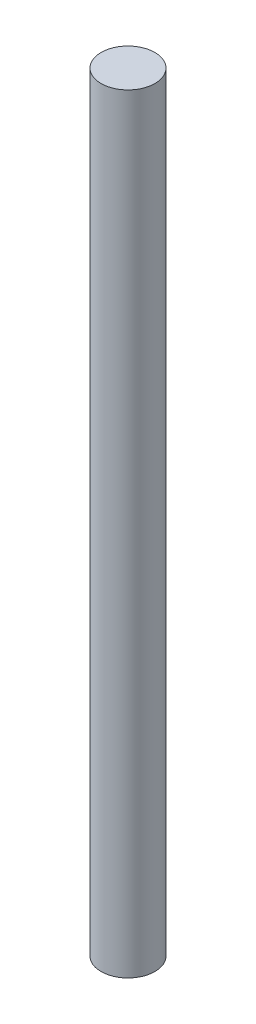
SolidWorks part; units mm, degrees
ref_plane "Piano frontale" through (0, 0, 0) normal (0, 0, 1) x (1, 0, 0)
ref_plane "Piano superiore" through (0, 0, 0) normal (0, 1, 0) x (1, 0, 0)
ref_plane "Piano destro" through (0, 0, 0) normal (1, 0, 0) x (0, 0, -1)
sketch "Schizzo1" plane through (0, 0, 0) normal (0, 1, 0) x (1, 0, 0)
  circle A0 centre (0, 0) radius 17.5
  dimension "D1" = 35
extrude "Estrusione-Estrusione1" add sketch "Schizzo1" along normal blind 500
